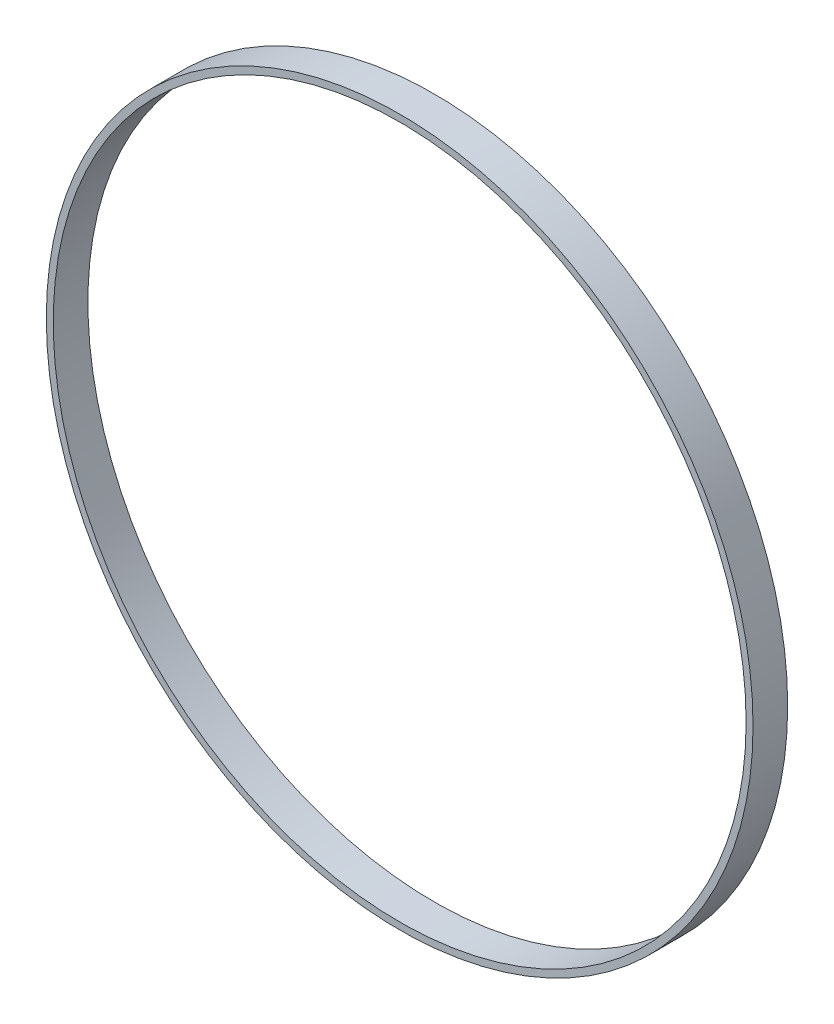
SolidWorks part; units mm, degrees
ref_plane "Plan de face" through (0, 0, 0) normal (0, 0, 1) x (1, 0, 0)
ref_plane "Plan de dessus" through (0, 0, 0) normal (0, 1, 0) x (1, 0, 0)
ref_plane "Plan de droite" through (0, 0, 0) normal (1, 0, 0) x (0, 0, -1)
sketch "Esquisse1" plane through (0, 0, 0) normal (0, 0, 1) x (1, 0, 0)
  circle A0 centre (0, 0) radius 50
  circle A1 centre (0, 0) radius 51
  dimension "D1" = 100
  dimension "D2" = 102
extrude "Extrusion1" add sketch "Esquisse1" along normal blind 5
